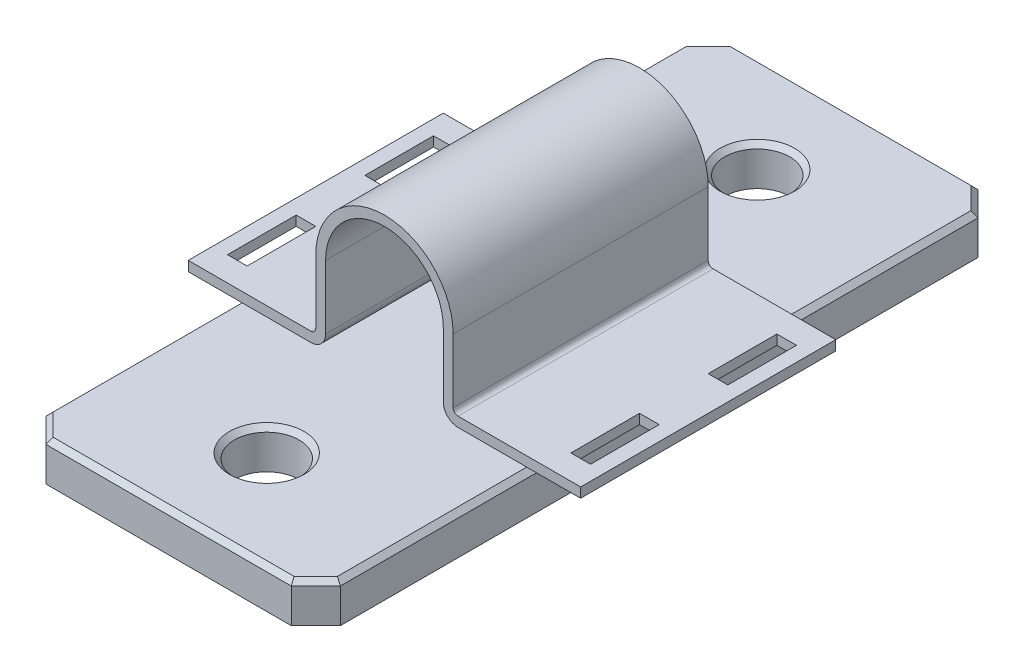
SolidWorks part; units mm, degrees
ref_plane "Front" through (0, 0, 0) normal (0, 0, 1) x (1, 0, 0)
ref_plane "Top" through (0, 0, 0) normal (0, 1, 0) x (1, 0, 0)
ref_plane "Right" through (0, 0, 0) normal (1, 0, 0) x (0, 0, -1)
sketch "Sketch4" plane through (0, 0, 0) normal (0, 1, 0) x (1, 0, 0)
  line L1 (15, -35) -> (-15, -35)
  line L2 (15, -35) -> (15, 35)
  line L3 (15, 35) -> (-15, 35)
  line L4 (-15, -35) -> (-15, 35)
  line L5 (15, -35) -> (-15, 35) construction
  line L6 (15, 35) -> (-15, -35) construction
  point P0 (0, 0)
  dimension "D1" = 30
  dimension "D2" = 70
extrude "Boss-Extrude2" add sketch "Sketch4" along normal blind 4
hole_wizard "M6 Clearance Hole1" positions "Sketch6" profile "Sketch7" hole size "M6" standard "ISO"
sketch "Sketch6" plane through (0, 4, 0) normal (0, 1, 0) x (1, 0, 0)
  line L0 (0, 25) -> (0, -25) construction
  point P0 (0, -25)
  point P2 (0, 25)
  dimension "D1" = 50
sketch "Sketch7" plane through (0, 4, 25) normal (1, 0, 0) x (0, 0, 1)
  line L0 (0, 0) -> (0, 4)
  line L1 (0, 4) -> (3.3, 4)
  line L2 (3.3, 4) -> (3.3, 0)
  line L5 (3.3, 0) -> (0, 0)
  line L11 (0, -6.35) -> (0, 107.95) construction
  dimension "Thru Hole Dia." = 6.6
  dimension "Thru Hole Depth" = 4
chamfer "Chamfer2" distance 2.5 angle 45 4 edges at (15, 2, -35) (-15, 2, -35) (-15, 2, 35) (15, 2, 35)
chamfer "Chamfer3" distance 0.5 angle 45 10 edges at (13.75, 4, 33.75) (0, 4, 35) (-13.75, 4, 33.75) (-15, 4, 0) (-13.75, 4, -33.75) (0, 4, -35) (13.75, 4, -33.75) (15, 4, 0) (0, 4, -21.7) (0, 4, 28.3)
sketch "Sketch9" plane through (0, 0, 0) normal (0, 0, 1) x (1, 0, 0)
  line L0 (0, 0) -> (0, 12) construction
  line L1 (-20, 4) -> (-7.5, 4)
  line L2 (-6, 5.5) -> (-6, 12)
  line L3 (6, 12) -> (6, 5.5)
  line L4 (7.5, 4) -> (20, 4)
  line L5 (-12.2929, 4) -> (12.2929, 4) construction
  arc A0 (-6, 12) -> (6, 12) centre (0, 12) cw
  arc A1 (-7.5, 4) -> (-6, 5.5) centre (-7.5, 5.5) ccw
  arc A2 (6, 5.5) -> (7.5, 4) centre (7.5, 5.5) ccw
  dimension "D1" = 1.5
  dimension "D2" = 12
  dimension "D3" = 8
  dimension "D4" = 40
extrude "Extrude-Thin1" add sketch "Sketch9" along normal mid plane 26 thin
sketch "Sketch10" plane through (0, 5, 0) normal (0, 1, 0) x (1, 0, 0)
  line L0 (17.5, -13) -> (17.5, -10.5) construction
  line L1 (16.5, -3.5) -> (18.5, -3.5)
  line L2 (16.5, -3.5) -> (16.5, -10.5)
  line L3 (16.5, -10.5) -> (18.5, -10.5)
  line L4 (18.5, -3.5) -> (18.5, -10.5)
  line L5 (16.5, -3.5) -> (18.5, -10.5) construction
  line L6 (16.5, -10.5) -> (18.5, -3.5) construction
  line L7 (16.5, 10.5) -> (18.5, 10.5)
  line L8 (16.5, 10.5) -> (16.5, 3.5)
  line L9 (16.5, 3.5) -> (18.5, 3.5)
  line L10 (18.5, 10.5) -> (18.5, 3.5)
  line L11 (16.5, 10.5) -> (18.5, 3.5) construction
  line L12 (16.5, 3.5) -> (18.5, 10.5) construction
  line L13 (7.5, -13) -> (20, -13) construction
  line L14 (17.5, 10.5) -> (17.5, 13) construction
  line L15 (7.5, 13) -> (20, 13) construction
  line L16 (20, -13) -> (20, 13) construction
  point P4 (17.5, -7)
  point P9 (17.5, 7)
  dimension "D1" = 2
  dimension "D2" = 1.5
  dimension "D3" = 7
  dimension "D4" = 2.5
extrude "Cut-Extrude1" cut sketch "Sketch10" against normal up to next
mirror "Mirror1" about plane through (0, 0, 0) normal (1, 0, 0) of "Cut-Extrude1"
